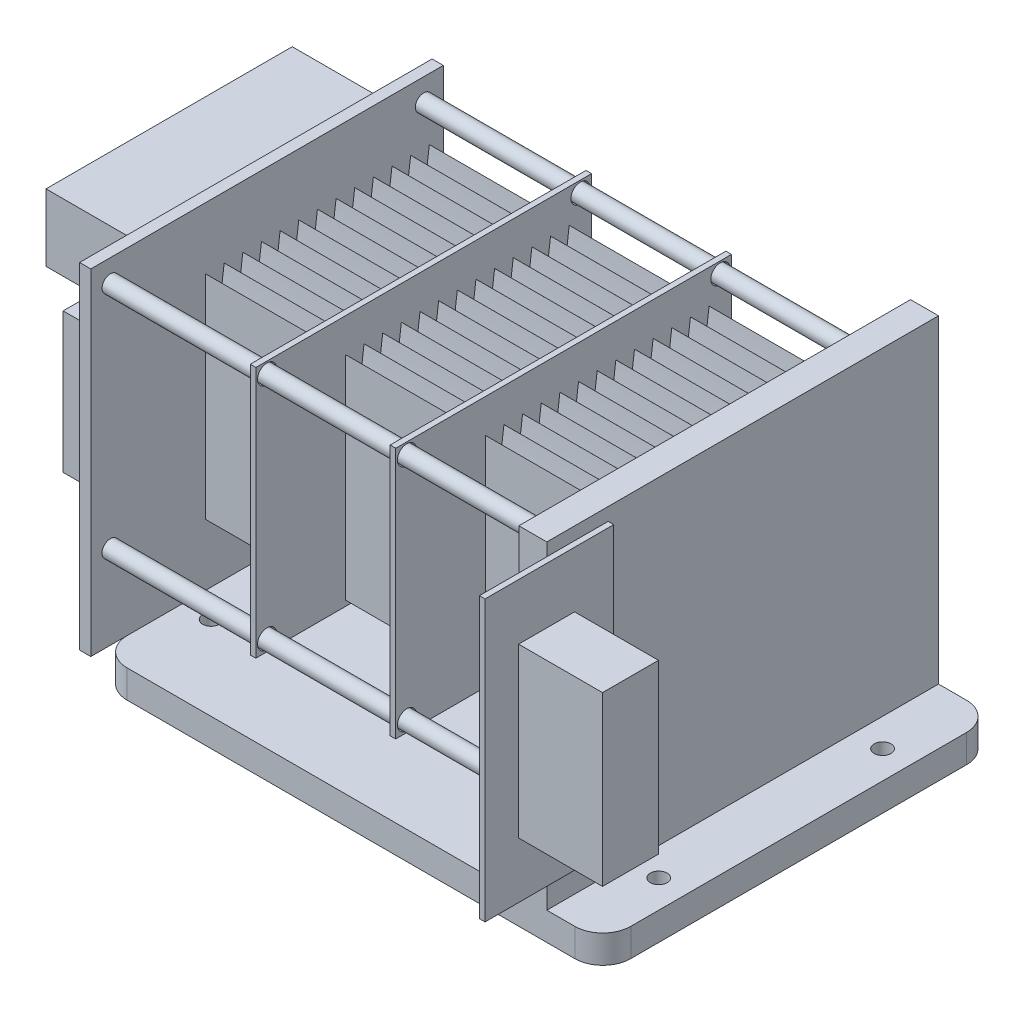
SolidWorks part; units mm, degrees
ref_plane "Front Plane" through (0, 0, 0) normal (0, 0, 1) x (1, 0, 0)
ref_plane "Top Plane" through (0, 0, 0) normal (0, 1, 0) x (1, 0, 0)
ref_plane "Right Plane" through (0, 0, 0) normal (1, 0, 0) x (0, 0, -1)
sketch "Sketch1" plane through (0, 0, 0) normal (0, 1, 0) x (1, 0, 0)
  line L1 (-40, -35) -> (40, -35)
  line L2 (-45, -30) -> (-45, 30)
  line L3 (-40, 35) -> (40, 35)
  line L4 (45, -30) -> (45, 30)
  line L5 (-45, -35) -> (45, 35) construction
  line L6 (-45, 35) -> (45, -35) construction
  arc A0 (-40, -35) -> (-45, -30) centre (-40, -30) cw
  arc A1 (40, -35) -> (45, -30) centre (40, -30) ccw
  arc A2 (40, 35) -> (45, 30) centre (40, 30) cw
  arc A3 (-45, 30) -> (-40, 35) centre (-40, 30) cw
  point P0 (0, 0)
  dimension "D3" = 5
  dimension "D1" = 90
  dimension "D2" = 70
extrude "Boss-Extrude1" add sketch "Sketch1" along normal blind 5
sketch "Sketch2" plane through (0, 5, 0) normal (0, 1, 0) x (1, 0, 0)
  line L0 (30, -35) -> (30, 35)
  line L1 (-40, -35) -> (40, -35) construction
  line L2 (40, 35) -> (-40, 35) construction
  line L3 (30, -35) -> (35, -35)
  line L4 (35, -35) -> (35, 35)
  line L5 (35, 35) -> (30, 35)
  line L6 (45, -30) -> (45, 30) construction
  dimension "D1" = 15
  dimension "D2" = 5
extrude "Boss-Extrude2" add sketch "Sketch2" along normal blind 57
ref_plane "Plane1" through (-50, 0, 0) normal (-1, 0, 0) x (0, 0, 1)
sketch "Sketch3" plane through (-50, 0, 0) normal (-1, 0, 0) x (0, 0, 1)
  line L0 (-30, 0) -> (30, 0) construction
  line L1 (-31.5, 0) -> (31.5, 0)
  line L2 (-31.5, 0) -> (-31.5, 60)
  line L3 (-31.5, 60) -> (31.5, 60)
  line L4 (31.5, 0) -> (31.5, 60)
  line L5 (-35, 5) -> (-35, 0) construction
  dimension "D1" = 63
  dimension "D2" = 60
  dimension "D3" = 0
  dimension "D4" = 3.5
extrude "Boss-Extrude3" add sketch "Sketch3" along normal blind 2 separate body
ref_plane "Plane2" through (28, 0, 0) normal (-1, 0, 0) x (0, 0, 1)
sketch "Sketch4" plane through (28, 0, 0) normal (-1, 0, 0) x (0, 0, 1)
  line L0 (-35, 62) -> (35, 62) construction
  line L1 (30, 13) -> (-30, 13)
  line L2 (30, 13) -> (30, 58)
  line L3 (30, 58) -> (-30, 58)
  line L4 (-30, 13) -> (-30, 58)
  line L5 (30, 13) -> (-30, 58) construction
  line L6 (30, 58) -> (-30, 13) construction
  line L7 (-35, 62) -> (-35, 5) construction
  circle A0 centre (-28, 56) radius 1.7007
  circle A1 centre (-28, 15) radius 1.7007
  circle A2 centre (28, 56) radius 1.7007
  circle A3 centre (28, 15) radius 1.7007
  point P0 (0, 35.5)
  dimension "D1" = 60
  dimension "D2" = 45
  dimension "D3" = 4
  dimension "D4" = 5
  dimension "D5" = 2
  dimension "D6" = 2
  dimension "D7" = 2
  dimension "D8" = 2
  dimension "D9" = 2
  dimension "D10" = 2
  dimension "D11" = 2
  dimension "D12" = 2
extrude "Boss-Extrude4" add sketch "Sketch4" along normal blind 1 separate body
sketch "Sketch6" plane through (27, 0, 0) normal (-1, 0, 0) x (0, 0, 1)
  line L0 (-30, 13) -> (30, 13) construction
  line L1 (-20, 20) -> (20, 20)
  line L2 (-20, 20) -> (-20, 50)
  line L3 (-20, 50) -> (20, 50)
  line L4 (20, 20) -> (20, 50)
  line L5 (-30, 58) -> (-30, 13) construction
  line L6 (30, 13) -> (30, 58) construction
  dimension "D1" = 30
  dimension "D2" = 7
  dimension "D3" = 10
  dimension "D4" = 10
extrude "Boss-Extrude5" add sketch "Sketch6" along normal blind 18 contours L3 L4 L1 L2
sketch "Sketch8" plane through (27, 0, 0) normal (-1, 0, 0) x (0, 0, 1)
  line L0 (-20, 50) -> (-20, 58)
  line L1 (30, 58) -> (-30, 58) construction
  line L2 (20, 50) -> (20, 58)
  line L3 (20, 58) -> (-20, 58)
  line L5 (-20, 50) -> (20, 50) construction
  line L6 (-20, 58) -> (-16.667, 58) construction
  spline S0 degree 2 poles (-20, 58) (-18.3312, 42) (-16.67, 58) knots 0 0 0 1 1 1
  spline S1 degree 2 poles (-16.667, 58) (-14.9982, 42) (-13.337, 58) knots 0 0 0 1 1 1
  spline S2 degree 2 poles (-13.334, 58) (-11.6652, 42) (-10.004, 58) knots 0 0 0 1 1 1
  spline S3 degree 2 poles (-10.001, 58) (-8.3322, 42) (-6.671, 58) knots 0 0 0 1 1 1
  spline S4 degree 2 poles (-6.668, 58) (-4.9992, 42) (-3.338, 58) knots 0 0 0 1 1 1
  spline S5 degree 2 poles (-3.335, 58) (-1.6662, 42) (-0.005, 58) knots 0 0 0 1 1 1
  spline S6 degree 2 poles (-0.002, 58) (1.6668, 42) (3.328, 58) knots 0 0 0 1 1 1
  spline S7 degree 2 poles (3.331, 58) (4.9998, 42) (6.661, 58) knots 0 0 0 1 1 1
  spline S8 degree 2 poles (6.664, 58) (8.3328, 42) (9.994, 58) knots 0 0 0 1 1 1
  spline S9 degree 2 poles (9.997, 58) (11.6658, 42) (13.327, 58) knots 0 0 0 1 1 1
  spline S10 degree 2 poles (13.33, 58) (14.9988, 42) (16.66, 58) knots 0 0 0 1 1 1
  spline S11 degree 2 poles (16.663, 58) (18.3286, 42) (20, 58) knots 0 0 0 1 1 1
  dimension "D2" = 1.667
  dimension "D3" = 3.333
extrude "Boss-Extrude6" add sketch "Sketch8" along normal blind 18 contours S0 L0 M10 | S1 S0 M7 M10 | S2 S1 M7 M10 | S3 S2 M7 M10 | S4 S3 M7 M10 | S5 S4 M7 M10 | S6 S5 M7 M10 | S7 S6 M7 M10 | S8 S7 M7 M10 | S9 S8 M7 M10 | S10 S9 M7 M10 | S11 L3 S10 M10 | S11 L2 M10
pattern_linear "LPattern2" count 3 spacing 25 along (1, 0, 0)
sketch "Sketch9" plane through (30, 0, 0) normal (-1, 0, 0) x (0, 0, 1)
  circle A0 centre (28, 56) radius 1.5
  circle A1 centre (-28, 56) radius 1.5
  circle A2 centre (-28, 15) radius 1.5
  circle A3 centre (28, 15) radius 1.5
  circle A5 centre (28, 56) radius 1.7007 construction
  circle A6 centre (28, 15) radius 1.7007 construction
  circle A7 centre (-28, 15) radius 1.7007 construction
  dimension "D1" = 3
  dimension "D2" = 0
  dimension "D3" = 0
  dimension "D4" = 0
extrude "Boss-Extrude7" add sketch "Sketch9" along normal up to surface (80 mm away)
sketch "Sketch10" plane through (-52, 0, 0) normal (-1, 0, 0) x (0, 0, 1)
  line L1 (-21.5, 59.3949) -> (22.5033, 59.3949)
  line L2 (-21.5, 59.3949) -> (-21.5, 47.3949)
  line L3 (-21.5, 47.3949) -> (22.5033, 47.3949)
  line L4 (22.5033, 59.3949) -> (22.5033, 47.3949)
  line L5 (-31.5, 60) -> (-31.5, 0) construction
  line L7 (-30.8578, 45.2218) -> (-20.8578, 45.2218)
  line L8 (-30.8578, 45.2218) -> (-30.8578, 35.2218)
  line L9 (-30.8578, 35.2218) -> (-20.8578, 35.2218)
  line L10 (-20.8578, 45.2218) -> (-20.8578, 35.2218)
  line L11 (-20.162, 46.9131) -> (-5.162, 46.9131)
  line L12 (-20.162, 46.9131) -> (-20.162, 26.9131)
  line L13 (-20.162, 26.9131) -> (-5.162, 26.9131)
  line L14 (-5.162, 46.9131) -> (-5.162, 26.9131)
  line L15 (-3.6328, 46.8223) -> (11.3672, 46.8223)
  line L16 (-3.6328, 46.8223) -> (-3.6328, 26.8223)
  line L17 (-3.6328, 26.8223) -> (11.3672, 26.8223)
  line L18 (11.3672, 46.8223) -> (11.3672, 26.8223)
  dimension "D1" = 10
  dimension "D2" = 12
  dimension "D4" = 10
  dimension "D5" = 20
  dimension "D6" = 20
  dimension "D7" = 15
  dimension "D8" = 15
extrude "Boss-Extrude9" add sketch "Sketch10" along normal blind 15
sketch "Sketch15" plane through (-52, 0, 0) normal (-1, 0, 0) x (0, 0, 1)
  line L1 (12.4472, 46.9843) -> (27.4472, 46.9843)
  line L2 (12.4472, 46.9843) -> (12.4472, 21.9843)
  line L3 (12.4472, 21.9843) -> (27.4472, 21.9843)
  line L4 (27.4472, 46.9843) -> (27.4472, 21.9843)
  line L5 (-21.2518, 21.3731) -> (23.7482, 21.3731)
  line L6 (-21.2518, 21.3731) -> (-21.2518, 1.3731)
  line L7 (-21.2518, 1.3731) -> (23.7482, 1.3731)
  line L8 (23.7482, 21.3731) -> (23.7482, 1.3731)
  dimension "D1" = 15
  dimension "D2" = 25
  dimension "D3" = 45
  dimension "D4" = 20
extrude "Boss-Extrude10" add sketch "Sketch15" along normal blind 7
sketch "Sketch16" plane through (-52, 0, 0) normal (-1, 0, 0) x (0, 0, 1)
  line L1 (-28.7899, 30.1826) -> (-23.7899, 30.1826)
  line L2 (-28.7899, 30.1826) -> (-28.7899, 15.1826)
  line L3 (-28.7899, 15.1826) -> (-23.7899, 15.1826)
  line L4 (-23.7899, 30.1826) -> (-23.7899, 15.1826)
  dimension "D1" = 5
  dimension "D2" = 15
extrude "Boss-Extrude11" add sketch "Sketch16" along normal blind 15
sketch "Sketch17" plane through (35, 0, 0) normal (1, 0, 0) x (0, 0, -1)
  line L1 (-24.0447, 59.6991) -> (-47.0447, 59.6991)
  line L2 (-24.0447, 59.6991) -> (-24.0447, 9.6991)
  line L3 (-24.0447, 9.6991) -> (-47.0447, 9.6991)
  line L4 (-47.0447, 59.6991) -> (-47.0447, 9.6991)
  dimension "D1" = 23
  dimension "D2" = 50
extrude "Boss-Extrude12" add sketch "Sketch17" along normal blind 1
sketch "Sketch18" plane through (36, 0, 0) normal (1, 0, 0) x (0, 0, -1)
  line L0 (-47.0447, 59.6991) -> (-47.0447, 9.6991) construction
  line L1 (-41.0447, 49.6991) -> (-31.0447, 49.6991)
  line L2 (-41.0447, 49.6991) -> (-41.0447, 19.6991)
  line L3 (-41.0447, 19.6991) -> (-31.0447, 19.6991)
  line L4 (-31.0447, 49.6991) -> (-31.0447, 19.6991)
  line L5 (-24.0447, 59.6991) -> (-47.0447, 59.6991) construction
  dimension "D1" = 30
  dimension "D2" = 10
  dimension "D3" = 6
  dimension "D4" = 10
extrude "Boss-Extrude13" add sketch "Sketch18" along normal blind 15
sketch "Sketch19" plane through (0, 5, 0) normal (0, 1, 0) x (1, 0, 0)
  line L0 (45, -30) -> (45, 30) construction
  line L1 (45, 0) -> (35, 0) construction
  line L2 (35, -35) -> (35, 35) construction
  circle A0 centre (40, 20) radius 1.5
  point P4 (45, 0)
  point P10 (40, 0)
  dimension "D1" = 3
  dimension "D2" = 20
extrude "Cut-Extrude1" cut sketch "Sketch19" against normal through all
mirror "Mirror1" about plane through (0, 0, 0) normal (0, 0, 1) of "Cut-Extrude1"
mirror "Mirror2" about plane through (0, 0, 0) normal (1, 0, 0) of "Mirror1", "Cut-Extrude1"
